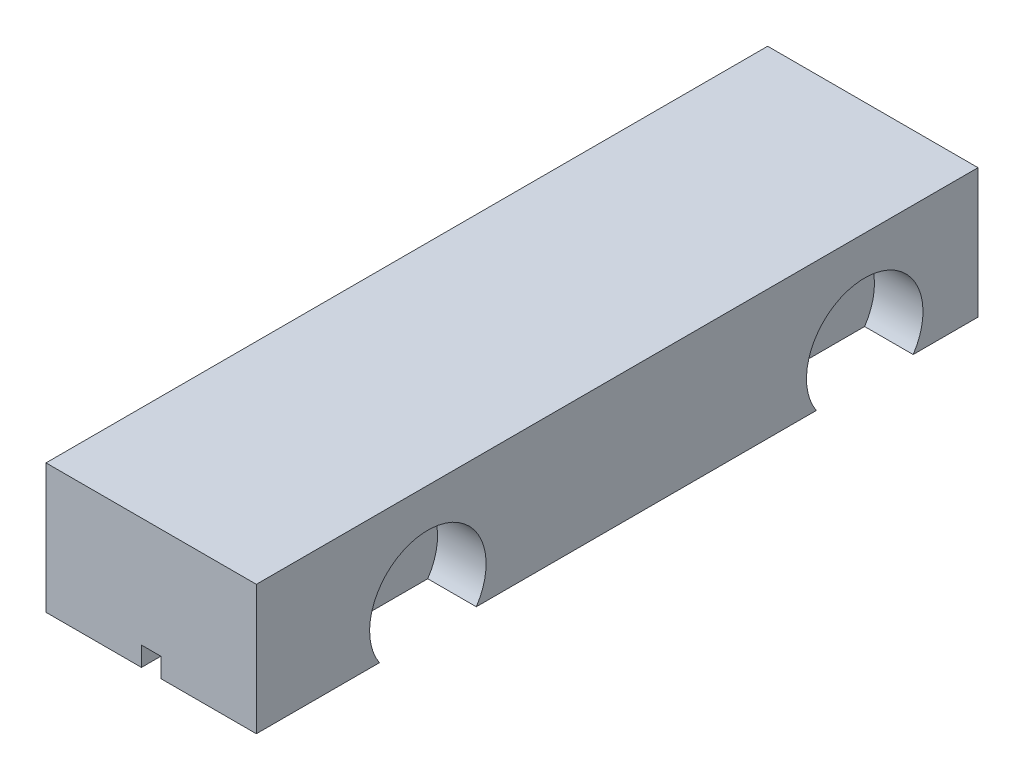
SolidWorks part; units mm, degrees
ref_plane "Front Plane" through (0, 0, 0) normal (0, 0, 1) x (1, 0, 0)
ref_plane "Top Plane" through (0, 0, 0) normal (0, 1, 0) x (1, 0, 0)
ref_plane "Right Plane" through (0, 0, 0) normal (1, 0, 0) x (0, 0, -1)
sketch "Sketch1" plane through (0, 0, 0) normal (0, 0, 1) x (1, 0, 0)
  line L1 (-32.5, 0) -> (32.5, 0)
  line L2 (-32.5, 0) -> (-32.5, 40)
  line L3 (-32.5, 40) -> (32.5, 40)
  line L4 (32.5, 0) -> (32.5, 40)
  dimension "D1" = 65
  dimension "D2" = 40
extrude "Balsa Block" add sketch "Sketch1" along normal blind 223
sketch "Sketch2" plane through (0, 0, 223) normal (0, 0, 1) x (1, 0, 0)
  line L0 (-32.5, 0) -> (32.5, 0) construction
  line L1 (-3, 0) -> (3, 0)
  line L2 (-3, 0) -> (-3, 6)
  line L3 (-3, 6) -> (3, 6)
  line L4 (3, 0) -> (3, 6)
  dimension "D1" = 6
  dimension "D2" = 6
extrude "Screw Eye Slot" cut sketch "Sketch2" against normal through all
sketch "Sketch4" plane through (32.5, 0, 0) normal (1, 0, 0) x (0, 0, -1)
  line L0 (-223, 0) -> (0, 0) construction
  line L1 (0, 0) -> (0, 40) construction
  circle A0 centre (-170, 10) radius 1.525
  circle A1 centre (-35, 10) radius 1.525
  dimension "D4" = 3.05
  dimension "D1" = 10
  dimension "D2" = 135
  dimension "D3" = 35
extrude "Axle Hole Cut Out" cut sketch "Sketch4" against normal through all
sketch "Esquisse1" plane through (32.5, 0, 0) normal (1, 0, 0) x (0, 0, -1)
  circle A0 centre (-170, 10) radius 18
  circle A1 centre (-35, 10) radius 18
  dimension "D1" = 36
  dimension "D2" = 36
extrude "Enlèv. mat.-Extru.1" cut sketch "Esquisse1" against normal blind 15
sketch "Esquisse2" plane through (-32.5, 0, 0) normal (-1, 0, 0) x (0, 0, 1)
  circle A0 centre (35, 10) radius 18
  circle A1 centre (170, 10) radius 18
  dimension "D1" = 36
  dimension "D2" = 36
extrude "Enlèv. mat.-Extru.2" cut sketch "Esquisse2" against normal blind 15
